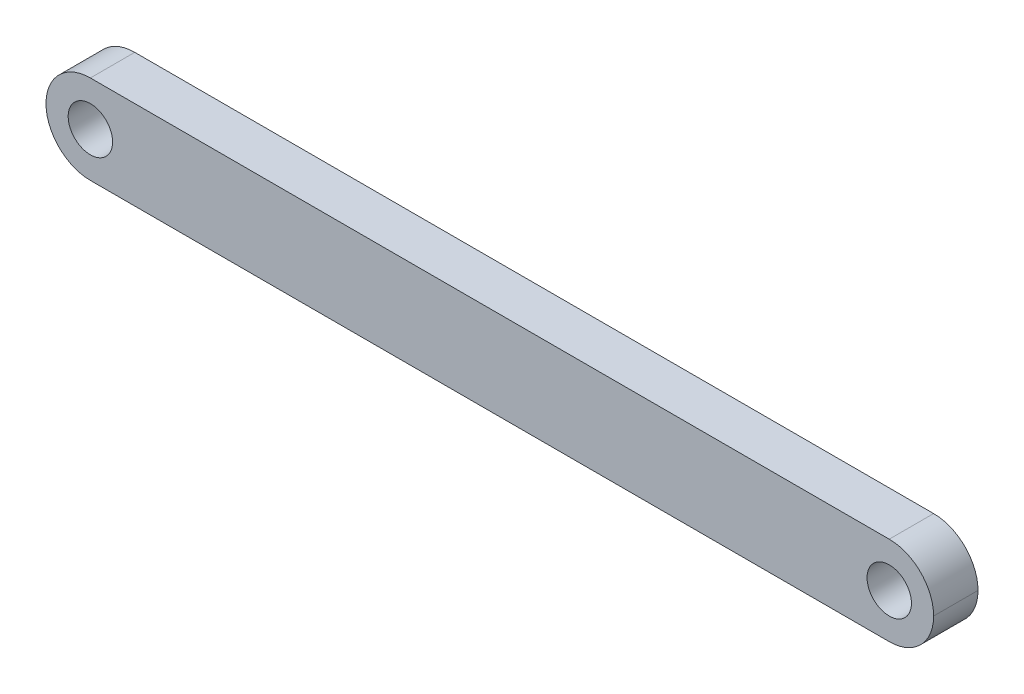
SolidWorks part; units mm, degrees
ref_plane "Front Plane" through (0, 0, 0) normal (0, 0, 1) x (1, 0, 0)
ref_plane "Top Plane" through (0, 0, 0) normal (0, 1, 0) x (1, 0, 0)
ref_plane "Right Plane" through (0, 0, 0) normal (1, 0, 0) x (0, 0, -1)
sketch "Sketch1" plane through (0, 0, 0) normal (0, 0, 1) x (1, 0, 0)
  line L1 (0, 0) -> (200, 0)
  line L2 (0, 0) -> (0, 20)
  line L3 (0, 20) -> (200, 20)
  line L4 (200, 0) -> (200, 20)
  dimension "D1" = 200
  dimension "D2" = 20
extrude "Boss-Extrude1" add sketch "Sketch1" along normal blind 10
fillet "Fillet1" radius 10 4 edges at (200, 0, 5) (200, 20, 5) (0, 0, 5) (0, 20, 5)
sketch "Sketch2" plane through (0, 0, 10) normal (0, 0, 1) x (1, 0, 0)
  line L0 (10, 0) -> (190, 0) construction
  circle A0 centre (10, 10) radius 5
  circle A1 centre (190, 10) radius 5
  dimension "D1" = 10
  dimension "D2" = 10
  dimension "D3" = 10
  dimension "D4" = 10
  dimension "D5" = 10
  dimension "D6" = 10
extrude "Cut-Extrude1" cut sketch "Sketch2" against normal through all
